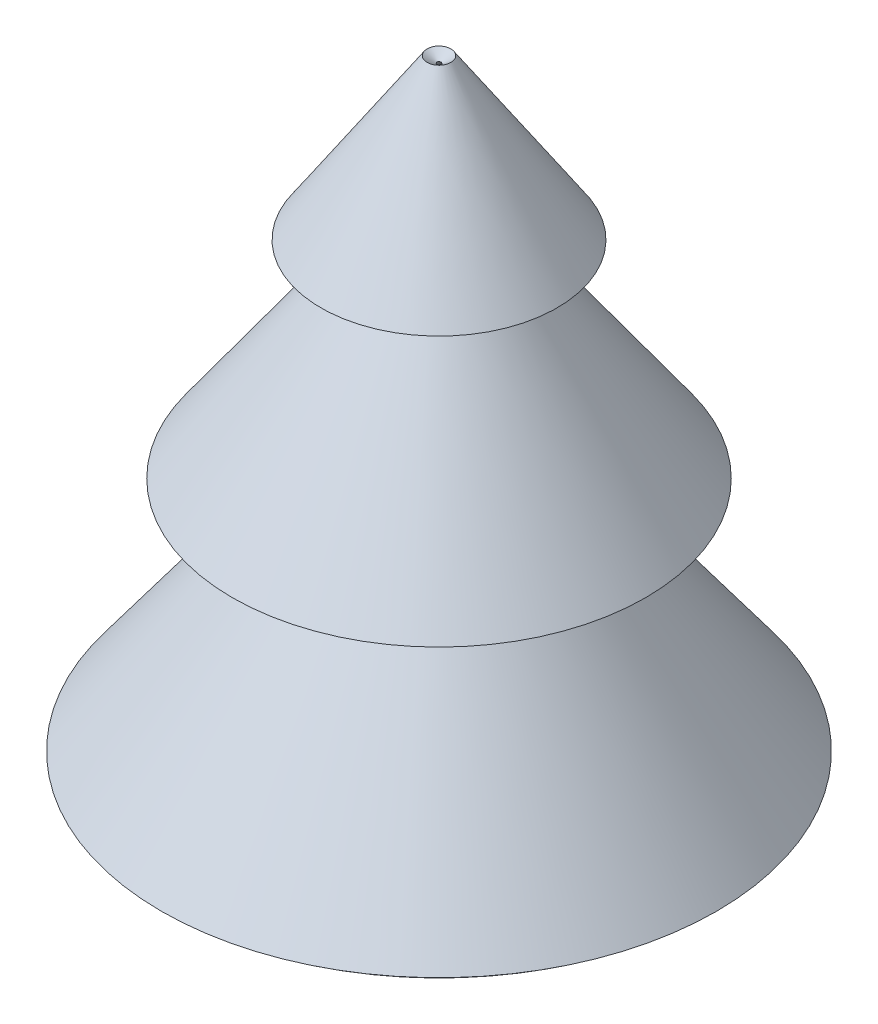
SolidWorks part; units mm, degrees
ref_plane "前视基准面" through (0, 0, 0) normal (0, 0, 1) x (1, 0, 0)
ref_plane "上视基准面" through (0, 0, 0) normal (0, 1, 0) x (1, 0, 0)
ref_plane "右视基准面" through (0, 0, 0) normal (1, 0, 0) x (0, 0, -1)
sketch "草图1" plane through (0, 0, 0) normal (0, 0, 1) x (1, 0, 0)
  line L0 (0, 0) -> (0, 117.8765) construction
  line L4 (-17.5, 40) -> (-35, 40)
  line L5 (-10, 75) -> (-20, 75)
  line L6 (-47, 0) -> (-17.5, 40)
  line L7 (-35, 40) -> (-10, 75)
  line L8 (-20, 75) -> (-2, 102)
revolve "旋转-薄壁18" add sketch "草图1" angle 360 about L0
